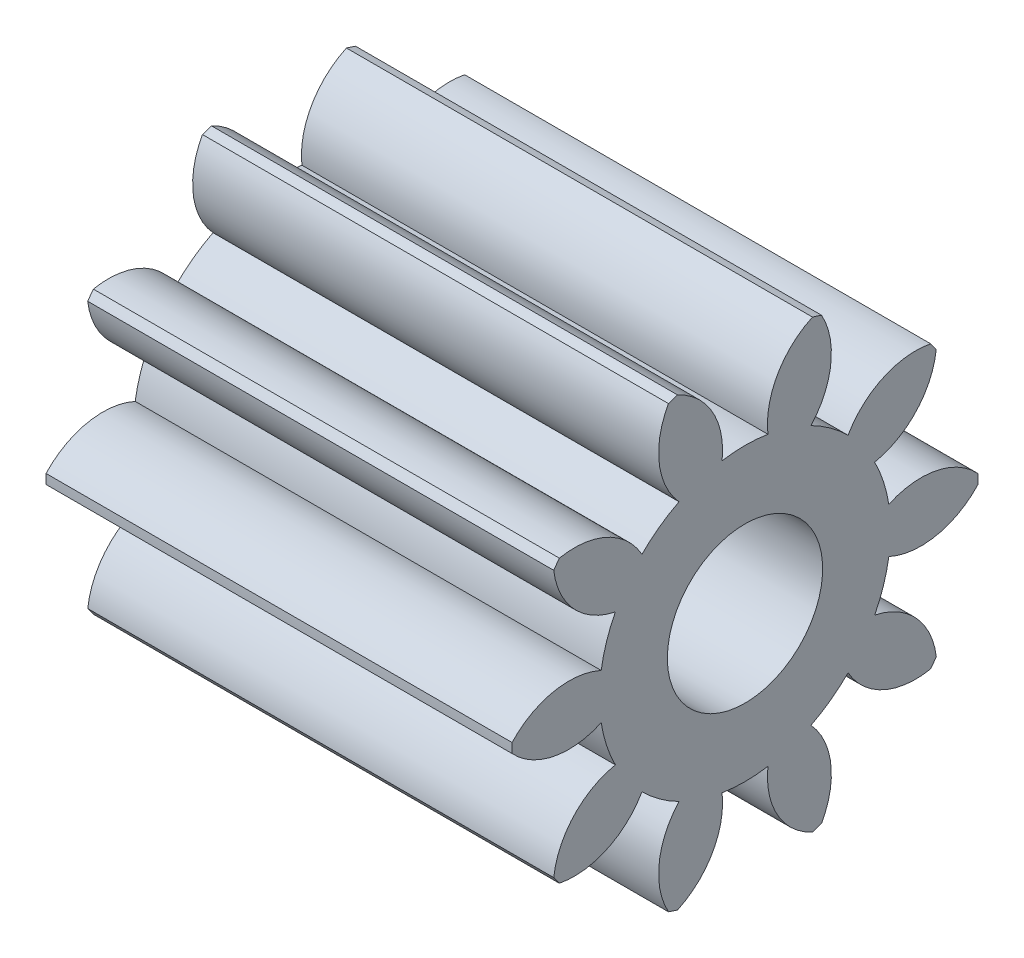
SolidWorks part; units mm, degrees
ref_plane "Plane1" through (0, 0, 0) normal (0, 0, 1) x (1, 0, 0)
ref_plane "Plane2" through (0, 0, 0) normal (0, 1, 0) x (1, 0, 0)
ref_plane "Plane3" through (0, 0, 0) normal (1, 0, 0) x (0, 0, -1)
other "Configuration Table"
sketch "HoldingSke" plane through (0, 0, 0) normal (0, 1, 0) x (1, 0, 0)
  line L0 (0, 0) -> (0.7878, -0.1389)
  line L1 (-15, 0) -> (100, 0) construction
  line L2 (0, 0) -> (-2.1039, 2.3779)
  line L3 (0, 0) -> (-11.863, 4.5341)
  line L4 (0, 0) -> (8.5048, 1.4996)
  line L5 (0, 0) -> (-46.8476, -17.4728)
  line L6 (0, 0) -> (-12.4344, -8.3896)
  line L7 (-2.1039, 2.3779) -> (8.6586, 51.2059)
  line L8 (-76.2, 54.61) -> (-75.3, 54.61)
  line L9 (-71.009, 38.7566) -> (-53.1078, 45.2721)
  line L10 (-76.2, 71.12) -> (104.1128, 71.12)
  line L11 (0, 0) -> (-15, 0)
  line L12 (-76.2, 101.6) -> (-76.155, 101.6)
  line L13 (24.9733, 27.94) -> (52.9518, 28.4284)
  line L14 (24.9733, 27.94) -> (24.9743, 27.94)
  line L15 (24.9733, 27.94) -> (100.4006, 29.5858)
  line L16 (-63.627, -1.25) -> (-12.827, -1.25)
  circle A0 centre (0, 0) radius 2.5
  circle A1 centre (0, 0) radius 4.6865
  circle A2 centre (0, 0) radius 37.5
  circle A3 centre (0, 0) radius 2.5
sketch "BasProSke" plane through (0, 0, 0) normal (0, 1, 0) x (1, 0, 0)
  line L0 (-10, 0) -> (60, 0) construction
  line L1 (0, 0) -> (0, 7.5)
  line L2 (0, 0) -> (15, 0)
  line L3 (15, 0) -> (15, 7.5)
  line L4 (15, 7.5) -> (0, 7.5)
revolve "Base-Revolve" add sketch "BasProSke" angle 360 about L0
sketch "TooCutSke" plane through (0, 0, 0) normal (1, 0, 0) x (0, 0, -1)
  line L1 (0, 0) -> (0, 107) construction
  line L2 (0, 0) -> (-1.0563, 6.1601) construction
  line L3 (0, 0) -> (-3.8225, 11.7646) construction
  line L4 (-1.0563, 6.1601) -> (-1.9113, 5.8823) construction
  arc A0 (0.7377, 4.6281) -> (-0.7377, 4.6281) centre (0, 0) ccw
  arc A1 (2.2058, 7.1949) -> (-2.2058, 7.1949) centre (0, 0) ccw
  circle A2 centre (0, 0) radius 6.25 construction
  circle A3 centre (0, 0) radius 5.8731 construction
  arc A4 (-0.7377, 4.6281) -> (-2.2058, 7.1949) centre (-3.2217, 4.9106) ccw
  arc A5 (2.2058, 7.1949) -> (0.7377, 4.6281) centre (3.2217, 4.9106) ccw
extrude "ToothCut" cut sketch "TooCutSke" along normal through all
fillet "Breaks" [suppressed] radius 0.025
fillet "RootFillets" [suppressed] radius 0.3135
pattern_circular "TeethCuts" count 10 every 36 about axis through (-10, 0, 0) along (1, 0, 0) of "ToothCut", "RootFillets", "Breaks"
sketch "HubNeaOneSke" plane through (0, 0, 0) normal (-1, 0, 0) x (0, 0, 1)
  circle A0 centre (0, 0) radius 4.6865
extrude "HubNearOne" [suppressed] add sketch "HubNeaOneSke" along normal blind 35.0001
sketch "HubNeaBotSke" plane through (0, 0, 0) normal (-1, 0, 0) x (0, 0, 1)
  circle A0 centre (0, 0) radius 4.6865
extrude "HubNearBoth" [suppressed] add sketch "HubNeaBotSke" along normal blind 17.5
ref_plane "FarPln" through (15, 0, 0) normal (1, 0, 0) x (0, 0, -1)
sketch "HubFarSke" plane through (15, 0, 0) normal (1, 0, 0) x (0, 0, -1)
  circle A0 centre (0, 0) radius 4.6865
extrude "HubFar" [suppressed] add sketch "HubFarSke" along normal blind 17.5
sketch "BorSke" plane through (0, 0, 0) normal (1, 0, 0) x (0, 0, -1)
  circle A0 centre (0, 0) radius 2.5
extrude "Bore" cut sketch "BorSke" along normal mid plane 100.0001
sketch "KeySke" plane through (0, 0, 0) normal (1, 0, 0) x (0, 0, -1)
  line L0 (-1, 0) -> (-1, 3.4)
  line L1 (-1, 3.4) -> (1, 3.4)
  line L2 (1, 3.4) -> (1, 0)
  line L3 (0, 0) -> (0, 34) construction
  line L4 (-1, 0) -> (1, 0)
extrude "Keyway" [suppressed] cut sketch "KeySke" along normal mid plane 100.0001
pattern_circular "Keyway2" [suppressed] count 2 every 90 about axis through (-10, 0, 0) along (1, 0, 0)
equation "' \"Module@HoldingSke\" = 6.35"
equation "' \"Num_teeth@HoldingSke\" = 12"
equation "' \"Ap@HoldingSke\" =  20"
equation "' \"Ap@HoldingSke\" = 20"
equation "' \"Width@HoldingSke\" = 0.5 * 25.4"
equation "' \"Hub_dia@HoldingSke\"= 1 * 25.4"
equation "' \"Hub_dia@HoldingSke\" = 1 * 25.4"
equation "' \"Overall_len@HoldingSke\" = 1.0 * 25.4"
equation "' \"Bore@HoldingSke\" = 0.75 * 25.4"
equation "' \"T_dim@HoldingSke\" = 0.1 * 25.4"
equation "' \"Width@KeySke\" = 0.25 * 25.4"
equation "' \"Show_teeth@HoldingSke\" = 13"
equation "' \"Backlash@HoldingSke\" = 0.009 * 25.4"
equation "' \"Addendum_fac@HoldingSke\" = 1.0"
equation "' \"Dedendum_fac@HoldingSke\" = 1.25"
equation "' \"Dedendum_add@HoldingSke\" = 0.00005 * 25.4"
equation "' \"Clearance_fac@HoldingSke\" = 0.25"
equation "\"Pitch@HoldingSke\" = 1 / \"Module@HoldingSke\""
equation "\"Overcut_dia@TooCutSke\" = (\"Num_teeth@HoldingSke\" + 2 * \"Addendum_fac@HoldingSke\") / \"Pitch@HoldingSke\" + 0.002 * 25.4"
equation "\"Pitch_dia@TooCutSke\" = \"Num_teeth@HoldingSke\" / \"Pitch@HoldingSke\""
equation "\"Base_dia@TooCutSke\" = \"Num_teeth@HoldingSke\" / \"Pitch@HoldingSke\" * cos((\"Ap@HoldingSke\"  * 3.14159265 / 180))"
equation "\"Root_dia@TooCutSke\" = (\"Num_teeth@HoldingSke\" + 2) / \"Pitch@HoldingSke\" - 2 * (\"Addendum_fac@HoldingSke\" + \"Dedendum_fac@HoldingSke\") / \"Pitch@HoldingSke\" - \"Dedendum_add@HoldingSke\" * 2"
equation "\"Half_ang@TooCutSke\" = 180 / \"Num_teeth@HoldingSke\""
equation "\"Half_CT@TooCutSke\" = \"Num_teeth@HoldingSke\" / \"Pitch@HoldingSke\" * sin((3.14159265 / 2 / \"Num_teeth@HoldingSke\")) / 2 - 7 * \"Backlash@HoldingSke\" / 4"
equation "\"Flank_rad@TooCutSke\" = \"Num_teeth@HoldingSke\" / \"Pitch@HoldingSke\" / 5"
equation "\"Radius@RootFillets\" = \"Clearance_fac@HoldingSke\" / \"Pitch@HoldingSke\" + \"Dedendum_add@HoldingSke\""
equation "\"Break_rad@Breaks\" = 0.02 / \"Pitch@HoldingSke\""
equation "\"Thickness@HoldingSke\" = \"Width@HoldingSke\""
equation "\"OAL@HoldingSke\" = \"Thickness@HoldingSke\""
equation "\"MHD@HoldingSke\" = (\"Num_teeth@HoldingSke\" + 2) / \"Pitch@HoldingSke\" - 2 * (\"Addendum_fac@HoldingSke\" + \"Dedendum_fac@HoldingSke\")  / \"Pitch@HoldingSke\" - \"Dedendum_add@HoldingSke\" * 2"
equation "\"MBD@HoldingSke\" = (\"Num_teeth@HoldingSke\" + 2) / \"Pitch@HoldingSke\" - 2 * (\"Addendum_fac@HoldingSke\" + \"Dedendum_fac@HoldingSke\")  / \"Pitch@HoldingSke\" - \"Dedendum_add@HoldingSke\" * 2 - 0.002 * 25.4"
equation "\"MHD@HoldingSke\" = ((sgn( \"MHD@HoldingSke\" - \"Hub_dia@HoldingSke\" )-1)*( \"MHD@HoldingSke\" - \"Hub_dia@HoldingSke\" ))/-2+ \"Hub_dia@HoldingSke\""
equation "\"MBD@HoldingSke\" = ((sgn( \"MBD@HoldingSke\" - \"Bore@HoldingSke\" )-1)*( \"MBD@HoldingSke\" - \"Bore@HoldingSke\" ))/-2+ \"Bore@HoldingSke\""
equation "\"OAL@HoldingSke\" = ((sgn( \"OAL@HoldingSke\" - \"Overall_len@HoldingSke\" )+1)*( \"OAL@HoldingSke\" - \"Overall_len@HoldingSke\" ))/2 + \"Overall_len@HoldingSke\" + 0.000002 * 25.4"
equation "\"Num_teeth@TeethCuts\" = int( \"Show_teeth@HoldingSke\" ) + 1"
equation "\"Num_teeth@TeethCuts\" = ((sgn( \"Num_teeth@TeethCuts\" - \"Num_teeth@HoldingSke\" )-1)*( \"Num_teeth@TeethCuts\" - \"Num_teeth@HoldingSke\" ))/-2+ \"Num_teeth@HoldingSke\""
equation "\"Num_teeth@TeethCuts\" = ((sgn( \"Num_teeth@TeethCuts\" - 2.0)+1)*( \"Num_teeth@TeethCuts\" - 2.0))/2 +2.0"
equation "\"Angle@TeethCuts\" = 360.0 / \"Num_teeth@HoldingSke\""
equation "\"Diameter@BasProSke\" = (\"Num_teeth@HoldingSke\" + 2 * \"Addendum_fac@HoldingSke\") / \"Pitch@HoldingSke\""
equation "\"Thickness@BasProSke\"  = \"Thickness@HoldingSke\""
equation "' \"Fillet_rad@BasProSke\" =  \"Thickness@HoldingSke\" * 0.05"
equation "' \"Fillet_rad@BasProSke\" = \"Thickness@HoldingSke\" * 0.05"
equation "\"MHD@HoldingSke\" = ((sgn( \"MHD@HoldingSke\" - \"Root_dia@TooCutSke\" )-1)*( \"MHD@HoldingSke\" - \"Root_dia@TooCutSke\" ))/-2+ \"Root_dia@TooCutSke\""
equation "\"Diameter@HubNeaOneSke\" = \"MHD@HoldingSke\""
equation "\"Length@HubNearOne\" = \"OAL@HoldingSke\" - \"Thickness@BasProSke\""
equation "\"Diameter@HubNeaBotSke\" = \"MHD@HoldingSke\""
equation "\"Length@HubNearBoth\" = ( \"OAL@HoldingSke\" - \"Thickness@BasProSke\" ) / 2.0"
equation "\"Thickness@FarPln\" = \"Thickness@BasProSke\""
equation "\"Diameter@HubFarSke\" = \"MHD@HoldingSke\""
equation "\"Length@HubFar\" = ( \"OAL@HoldingSke\" - \"Thickness@BasProSke\" ) / 2.0"
equation "\"Diameter@BorSke\" = \"MBD@HoldingSke\""
equation "\"D1@Bore\" = \"OAL@HoldingSke\" * 2.0"
equation "\"D1@Keyway\" = \"OAL@HoldingSke\" * 2.0"
equation "\"Offset@KeySke\" = \"T_dim@HoldingSke\" + \"MBD@HoldingSke\" / 2.0"
